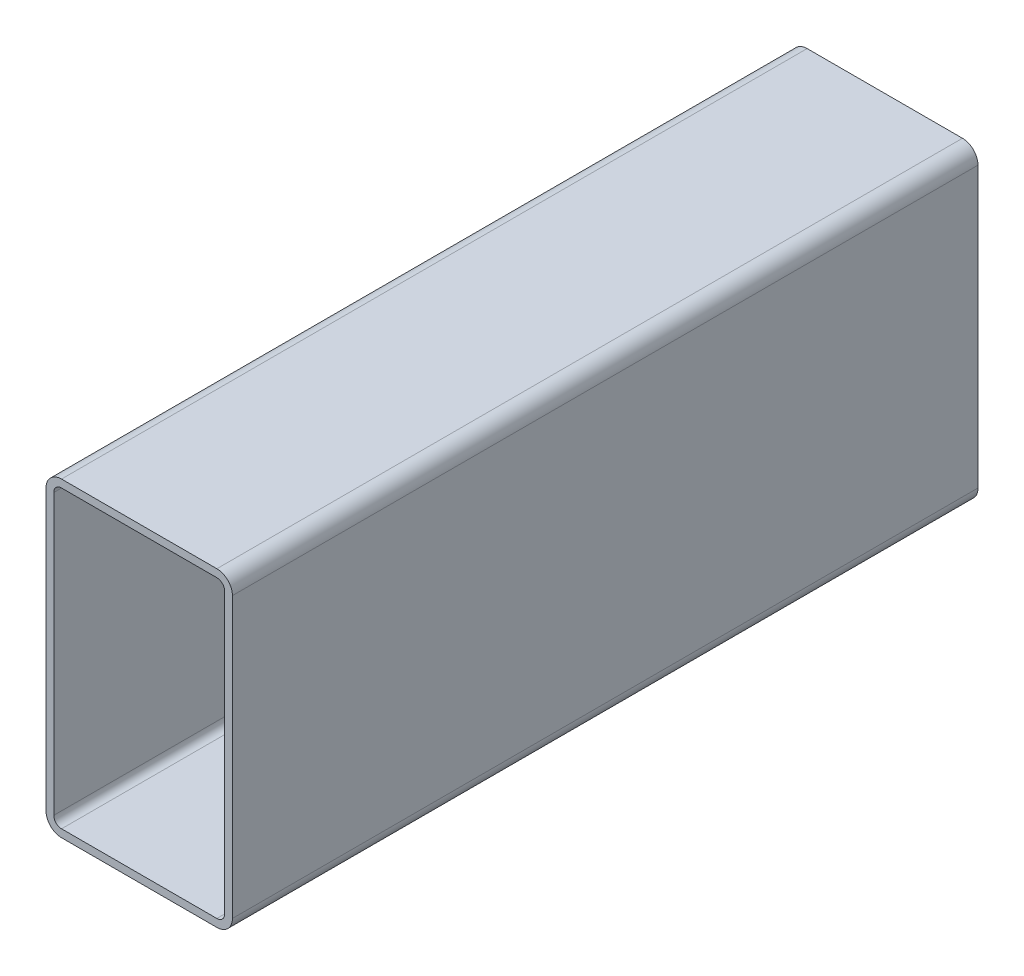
SolidWorks part; units mm, degrees
ref_plane "Front Plane" through (0, 0, 0) normal (0, 0, 1) x (1, 0, 0)
ref_plane "Top Plane" through (0, 0, 0) normal (0, 1, 0) x (1, 0, 0)
ref_plane "Right Plane" through (0, 0, 0) normal (1, 0, 0) x (0, 0, -1)
sketch "Sketch1" plane through (0, 0, 0) normal (0, 0, 1) x (1, 0, 0)
sketch_block_instance "HSS5x3x0.125-1"
sketch_block "HSS5x3x0.125"
extrude "Boss-Extrude1" add sketch "Sketch1" along normal blind 304.8
